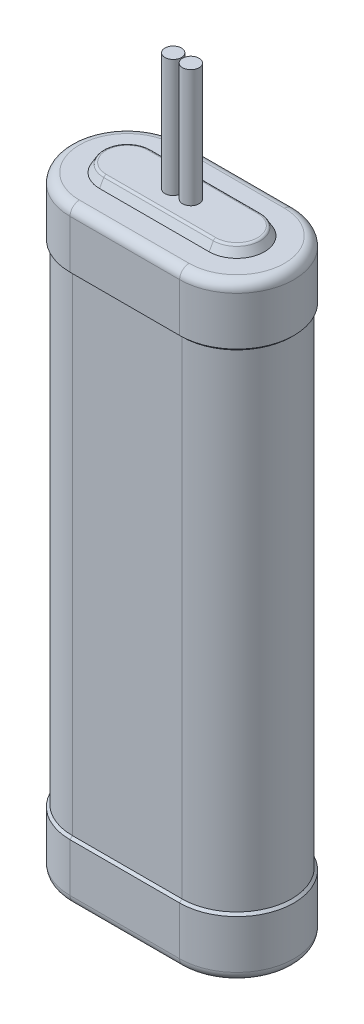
SolidWorks part; units mm, degrees
ref_plane "Front" through (0, 0, 0) normal (0, 0, 1) x (1, 0, 0)
ref_plane "Top" through (0, 0, 0) normal (0, 1, 0) x (1, 0, 0)
ref_plane "Right" through (0, 0, 0) normal (1, 0, 0) x (0, 0, -1)
sketch "Sketch1" plane through (0, 0, 0) normal (0, 1, 0) x (1, 0, 0)
  line L0 (-11.811, 12.319) -> (11.811, 12.319)
  line L1 (11.811, -12.319) -> (-11.811, -12.319)
  line L2 (24.13, 0) -> (-24.13, 0) construction
  arc A0 (11.811, -12.319) -> (11.811, 12.319) centre (11.811, 0) ccw
  arc A1 (-11.811, 12.319) -> (-11.811, -12.319) centre (-11.811, 0) ccw
  dimension "D2" = 12.319
  dimension "D1" = 23.622
extrude "Extrude1" add sketch "Sketch1" along normal mid plane 130.81
sketch "Sketch2" plane through (0, 0, 0) normal (0, 1, 0) x (1, 0, 0)
  line L0 (11.811, -11.811) -> (-11.811, -11.811)
  line L1 (-11.811, 11.811) -> (11.811, 11.811)
  arc A0 (11.811, -11.811) -> (11.811, 11.811) centre (11.811, 0) ccw
  arc A1 (-11.811, 11.811) -> (-11.811, -11.811) centre (-11.811, 0) ccw
  dimension "D2" = 11.811
  dimension "D1" = 23.622
extrude "Cut-Extrude1" cut sketch "Sketch2" against normal mid plane 104.902 flip side to cut
fillet "Fillet1" radius 2.032 8 edges at (0, -65.405, 12.319) (-24.13, -65.405, 0) (0, -65.405, -12.319) (0, 65.405, 12.319) (-24.13, 65.405, 0) (0, 65.405, -12.319) (24.13, -65.405, 0) (24.13, 65.405, 0)
chamfer "Chamfer1" distance 0.508 angle 45 8 edges at (-24.13, -52.451, 0) (0, -52.451, 12.319) (0, -52.451, -12.319) (24.13, -52.451, 0) (-24.13, 52.451, 0) (0, 52.451, 12.319) (0, 52.451, -12.319) (24.13, 52.451, 0)
sketch "Sketch3" plane through (0, 65.405, 0) normal (0, 1, 0) x (1, 0, 0)
  line L0 (-11.811, -5.969) -> (11.811, -5.969)
  line L1 (11.811, 5.969) -> (-11.811, 5.969)
  arc A0 (-11.811, 5.969) -> (-11.811, -5.969) centre (-11.811, 0) ccw
  arc A1 (11.811, -5.969) -> (11.811, 5.969) centre (11.811, 0) ccw
  dimension "D2" = 5.969
  dimension "D1" = 23.622
extrude "Extrude2" add sketch "Sketch3" along normal blind 1.905 draft 30
fillet "Fillet2" radius 0.635 4 edges at (0, 67.31, -4.8691) (16.6801, 67.31, 0) (0, 67.31, 4.8691) (-16.6801, 67.31, 0)
sketch "Sketch4" plane through (0, 67.31, 0) normal (0, 1, 0) x (1, 0, 0)
  line L0 (1.905, 0) -> (-1.905, 0) construction
  circle A0 centre (-1.905, 0) radius 1.778
  circle A1 centre (1.905, 0) radius 1.778
  dimension "D1" = 3.556
  dimension "D2" = 3.81
extrude "Extrude3" add sketch "Sketch4" along normal blind 25.4
